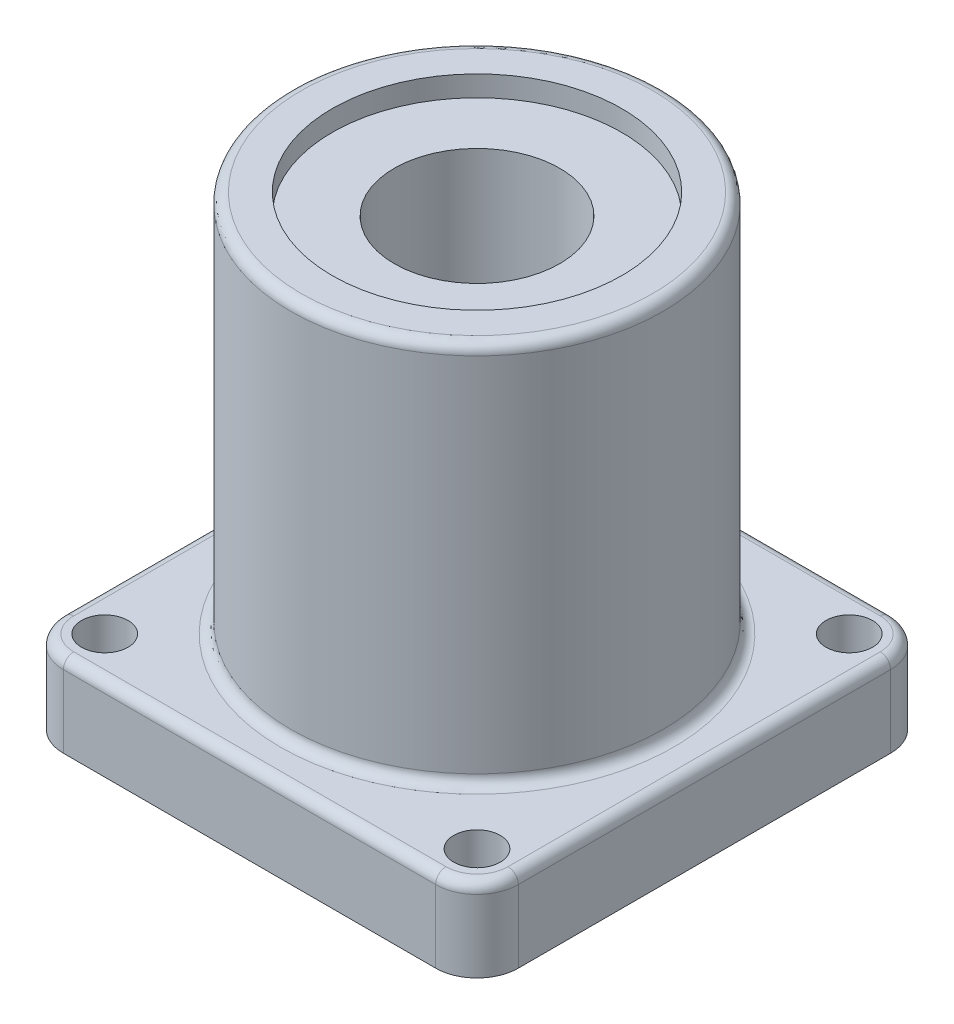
SolidWorks part; units mm, degrees
ref_plane "front" through (0, 0, 0) normal (0, 0, 1) x (1, 0, 0)
ref_plane "top" through (0, 0, 0) normal (0, 1, 0) x (1, 0, 0)
ref_plane "side" through (0, 0, 0) normal (1, 0, 0) x (0, 0, -1)
sketch "Sketch1" plane through (0, 0, 0) normal (0, 1, 0) x (1, 0, 0)
  line L0 (-34.925, -34.925) -> (34.925, -34.925)
  line L1 (-34.925, -34.925) -> (-34.925, 34.925)
  line L2 (34.925, 34.925) -> (-34.925, 34.925)
  line L3 (34.925, 34.925) -> (34.925, -34.925)
  line L4 (34.925, 0) -> (0, 0) construction
  line L5 (0, -34.925) -> (0, 0) construction
  dimension "D1" = 69.85
extrude "Base-Extrude" add sketch "Sketch1" along normal blind 12.7
sketch "Sketch2" plane through (0, 0, 0) normal (0, 1, 0) x (-1, 0, 0)
  circle A0 centre (0, 0) radius 28.575
  dimension "D1" = 57.15
extrude "Boss-Extrude1" add sketch "Sketch2" along normal blind 71.4375
sketch "Sketch3" plane through (0, 71.4375, 0) normal (0, 1, 0) x (-1, 0, 0)
  circle A0 centre (0, 0) radius 12.7
  dimension "D1" = 25.4
extrude "Cut-Extrude1" cut sketch "Sketch3" against normal through all
sketch "Sketch4" plane through (0, 71.4375, 0) normal (0, 1, 0) x (-1, 0, 0)
  circle A0 centre (0, 0) radius 22.225
  dimension "D1" = 44.45
extrude "Cut-Extrude2" cut sketch "Sketch4" against normal blind 3.175
fillet "Fillet1" radius 6.35 4 edges at (-34.925, 6.35, 34.925) (34.925, 6.35, 34.925) (34.925, 6.35, -34.925) (-34.925, 6.35, -34.925)
sketch "Sketch5" plane through (0, 0, 0) normal (0, -1, 0) x (1, 0, 0)
  circle A0 centre (28.575, 28.575) radius 3.5719
  arc A5 (34.925, 28.575) -> (28.575, 34.925) centre (28.575, 28.575) ccw construction
  dimension "D1" = 7.1437
extrude "Cut-Extrude3" cut sketch "Sketch5" against normal through all
pattern_linear "LPattern1" count 2 spacing 57.15 along (0, 0, -1) count 2 spacing 57.15 along (-1, 0, 0) of "Cut-Extrude3"
fillet "Fillet2" radius 1.5875 10 edges at (0, 12.7, -28.575) (0, 71.4375, 28.575) (34.925, 12.7, 0) (0, 12.7, 34.925) (-34.925, 12.7, 0) (0, 12.7, -34.925) (-33.0651, 12.7, -33.0651) (-33.0651, 12.7, 33.0651) (33.0651, 12.7, -33.0651) (33.0651, 12.7, 33.0651)
